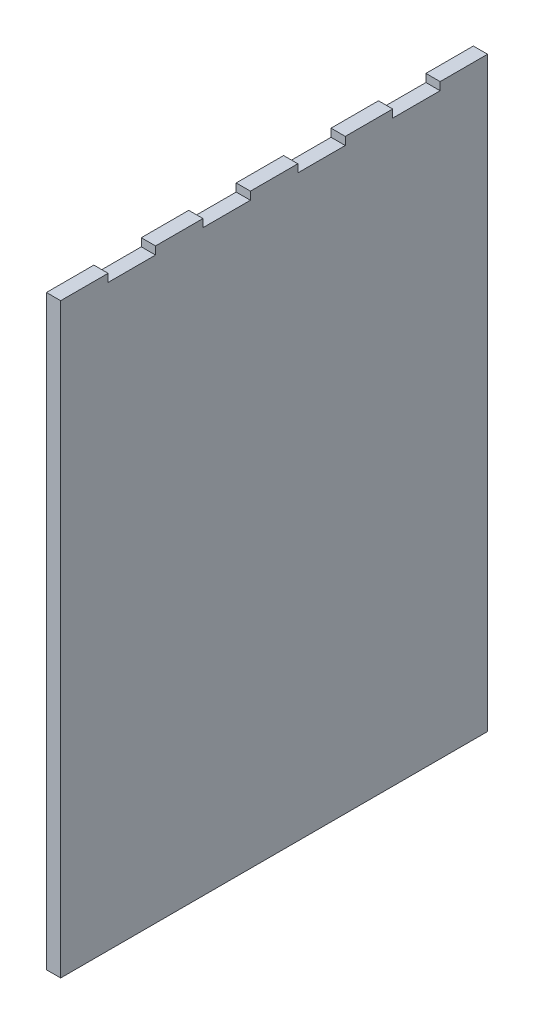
SolidWorks part; units mm, degrees
ref_plane "Front Plane" through (0, 0, 0) normal (0, 0, 1) x (1, 0, 0)
ref_plane "Top Plane" through (0, 0, 0) normal (0, 1, 0) x (1, 0, 0)
ref_plane "Right Plane" through (0, 0, 0) normal (1, 0, 0) x (0, 0, -1)
sketch "Sketch1" plane through (0, 0, 0) normal (1, 0, 0) x (0, 0, -1)
  line L1 (-532.4978, 277.8187) -> (7.5022, 277.8187)
  line L2 (-532.4978, 277.8187) -> (-532.4978, -454.1813)
  line L3 (-532.4978, -454.1813) -> (7.5022, -454.1813)
  line L4 (7.5022, 277.8187) -> (7.5022, -454.1813)
  dimension "D1" = 732
  dimension "D2" = 540
extrude "Boss-Extrude1" add sketch "Sketch1" along normal blind 18
sketch "Sketch3" plane through (18, 0, 0) normal (1, 0, 0) x (0, 0, -1)
  line L1 (-532.4978, 277.8187) -> (-472.4978, 277.8187)
  line L2 (-532.4978, 277.8187) -> (-532.4978, 287.8187)
  line L3 (-532.4978, 287.8187) -> (-472.4978, 287.8187)
  line L4 (-472.4978, 277.8187) -> (-472.4978, 287.8187)
  dimension "D1" = 60
  dimension "D2" = 10
extrude "Boss-Extrude4" add sketch "Sketch3" against normal blind 18
pattern_linear "LPattern1" count 5 spacing 120 along (0, 0, -1) of "Boss-Extrude4"
